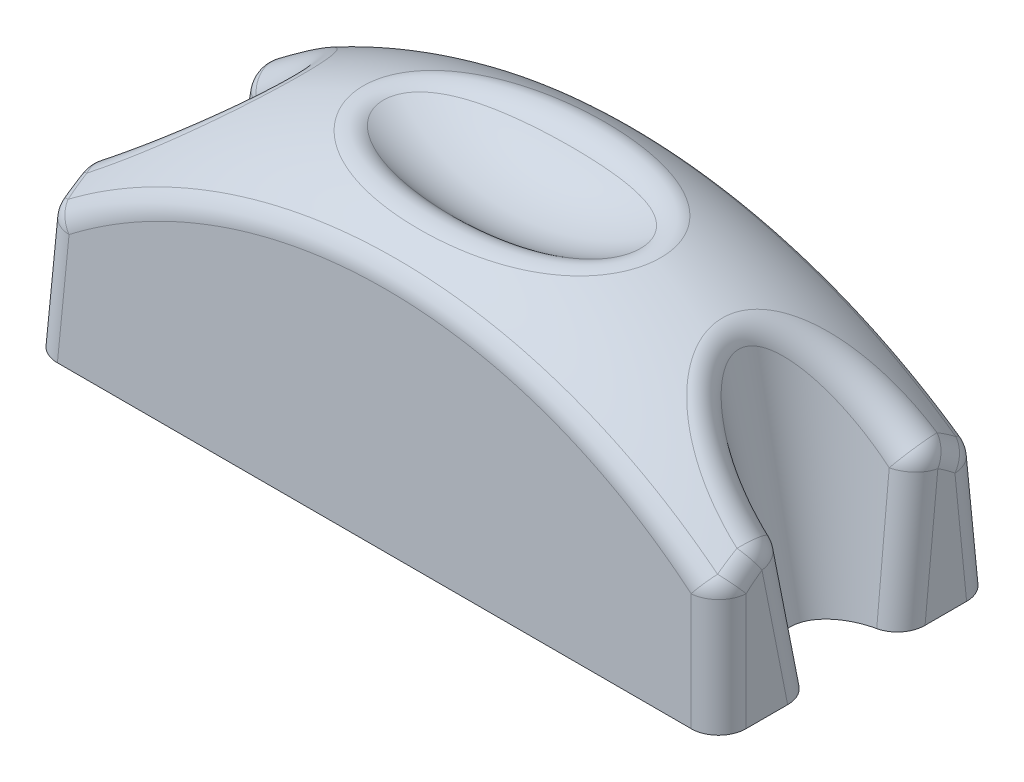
SolidWorks part; units mm, degrees
ref_plane "Front Plane" through (0, 0, 0) normal (0, 0, 1) x (1, 0, 0)
ref_plane "Top Plane" through (0, 0, 0) normal (0, 1, 0) x (1, 0, 0)
ref_plane "Right Plane" through (0, 0, 0) normal (1, 0, 0) x (0, 0, -1)
sketch "Sketch1" plane through (0, 0, 0) normal (0, 1, 0) x (1, 0, 0)
  line L1 (-62.5, -25) -> (62.5, -25)
  line L2 (-62.5, -25) -> (-62.5, 25)
  line L3 (-62.5, 25) -> (62.5, 25)
  line L4 (62.5, -25) -> (62.5, 25)
  line L5 (-62.5, -25) -> (62.5, 25) construction
  line L6 (-62.5, 25) -> (62.5, -25) construction
  point P0 (0, 0)
  dimension "D1" = 125
  dimension "D2" = 50
extrude "Boss-Extrude1" add sketch "Sketch1" along normal blind 50
sketch "Sketch2" plane through (0, 0, 0) normal (0, 0, 1) x (1, 0, 0)
  line L0 (-62.5, 50) -> (-62.5, 0) construction
  line L1 (62.5, 50) -> (62.5, 0) construction
  line L2 (-62.5, 50) -> (62.5, 50) construction
  arc A0 (-62.5, 28.0625) -> (62.5, 28.0625) centre (0, -50) cw
  dimension "D1" = 100
sketch "Sketch3" plane through (0, 0, 0) normal (1, 0, 0) x (0, 0, -1)
  line L1 (25, 50) -> (25, 0) construction
  line L2 (-25, 50) -> (25, 50) construction
  line L3 (-25, 50) -> (-25, 0) construction
  arc A0 (-25, 39.4949) -> (25, 39.4949) centre (0, 15) cw
  dimension "D1" = 35
other "Boundary-Surface1"
other "SurfaceCut1"
sketch "Sketch4" plane through (0, 0, 0) normal (0, 0, 1) x (1, 0, 0)
  arc A0 (-25, 46.8246) -> (25, 46.8246) centre (0, 90.1259) ccw
  spline S0 degree 3 number of poles 334 (0, 50) -> (-62.5, 28.0625) construction
  spline S1 degree 3 number of poles 397 (62.5, 28.0625) -> (0, 50) construction
  dimension "D1" = 50
  dimension "D2" = 50
sketch "Sketch5" plane through (0, 0, 0) normal (1, 0, 0) x (0, 0, -1)
  arc A0 (-12.9307, 47.5235) -> (12.9307, 47.5235) centre (0, 55.1259) ccw
  spline S0 degree 3 number of poles 225 (0.0001, 50) -> (-25, 39.4949) construction
  spline S1 degree 3 number of poles 263 (25, 39.4949) -> (0.0001, 50) construction
  point P9 (0, 40.1259)
  dimension "D1" = 15
other "Boundary-Surface2"
other "SurfaceCut2"
sketch "Sketch6" plane through (0, 0, 0) normal (0, 1, 0) x (1, 0, 0)
  line L0 (62.5, -25) -> (62.5, 25) construction
  ellipse E0 centre (62.5, 0) end of major axis (50.5, 0) minor radius 8
  dimension "D1" = 24
  dimension "D2" = 16
ref_plane "Plane1" through (0, 50, 0) normal (0, 1, 0) x (1, 0, 0)
sketch "Sketch7" plane through (0, 50, 0) normal (0, 1, 0) x (1, 0, 0)
  ellipse E0 centre (62.5, 0) end of major axis (86.5, 0) minor radius 16
  dimension "D1" = 24
  dimension "D2" = 16
loft "Cut-Loft1" cut profiles "Sketch6", "Sketch7"
mirror "Mirror1" about plane through (0, 0, 0) normal (1, 0, 0) of "Cut-Loft1"
shell "Shell1" thickness 2
draft "Draft1" type of draft neutral plane draft angle 3 neutral plane "Top Plane" faces to draft 1 parameters "D1"=3
draft "Draft2" type of draft neutral plane draft angle 3 neutral plane "Top Plane" faces to draft 1 parameters "D1"=3
draft "Draft3" type of draft neutral plane draft angle 3 neutral plane "Top Plane" faces to draft 1 parameters "D1"=3
draft "Draft4" type of draft neutral plane draft angle 3 neutral plane "Top Plane" faces to draft 1 parameters "D1"=3
draft "Draft5" type of draft neutral plane draft angle 3 neutral plane "Top Plane" faces to draft 1 parameters "D1"=3
draft "Draft6" type of draft neutral plane draft angle 3 neutral plane "Top Plane" faces to draft 1 parameters "D1"=3
fillet "Fillet3" radius 5 19 edges at (61.9929, 9.6764, 24.4929) (-61.9929, 9.6764, 24.4929) (-61.9929, 9.6764, -24.4929) (61.9929, 9.6764, -24.4929) (0, 41.5351, -22.8232) (0, 41.5351, 22.8232) (13.4824, 47.1896, -11.3668) (50.5, 0, 0) (61.9324, 10.8296, 9.7187) (61.8087, 13.1915, -10.0928) (40.5712, 41.3997, -0.174) (-50.5, 0, 0) (-61.9324, 10.8296, -9.7187) (-61.8087, 13.1915, 10.0928) (-40.5712, 41.3997, 0.174)
draft "Draft7" type of draft neutral plane draft angle 3 neutral plane "Top Plane" faces to draft 1 parameters "D1"=3
draft "Draft8" type of draft neutral plane draft angle 3 neutral plane "Top Plane" faces to draft 1 parameters "D1"=3
draft "Draft9" type of draft neutral plane draft angle 3 neutral plane "Top Plane" faces to draft 1 parameters "D1"=3
draft "Draft10" type of draft neutral plane draft angle 3 neutral plane "Top Plane" faces to draft 1 parameters "D1"=3
draft "Draft11" type of draft neutral plane draft angle 3 neutral plane "Top Plane" faces to draft 1 parameters "D1"=3
draft "Draft12" type of draft neutral plane draft angle 3 neutral plane "Top Plane" faces to draft 1 parameters "D1"=3
fillet "Fillet4" radius 3 19 edges at (-59.9858, 9.8122, -22.4858) (59.9858, 9.8122, 22.4858) (-3.0483, 40.51, 20.877) (-8.795, 44.9348, 13.0039) (59.6706, 15.8254, -12.3933) (-3.0483, 40.51, -20.877) (59.9858, 9.8122, -22.4858) (-59.6706, 15.8254, 12.3933) (-59.9858, 9.8122, 22.4858) (48.5583, 0, 1.2921) (38.9707, 39.8856, -1.4725) (-48.5583, 0, 1.2921) (-38.9707, 39.8856, 1.4725)
scale "Scale1" bodies to scale 107 scale about centroid uniform scaling yes scale factor 1.1
